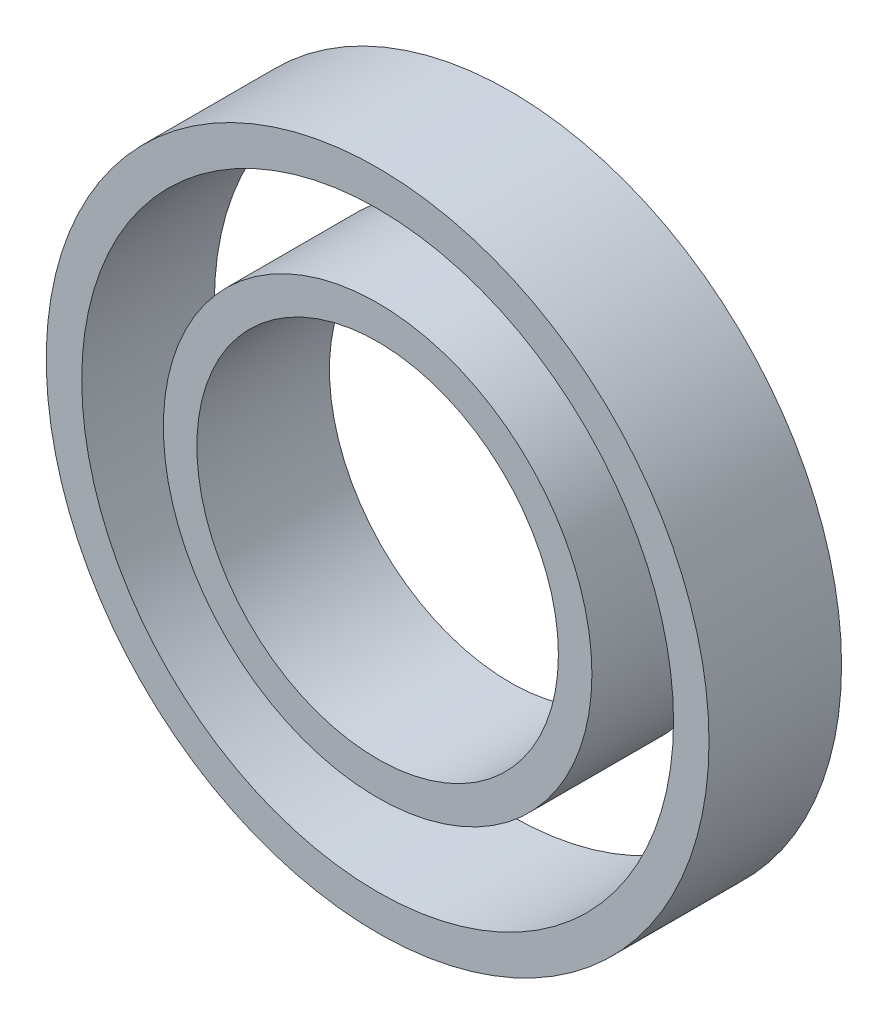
SolidWorks part; units mm, degrees
ref_plane "Front Plane" through (0, 0, 0) normal (0, 0, 1) x (1, 0, 0)
ref_plane "Top Plane" through (0, 0, 0) normal (0, 1, 0) x (1, 0, 0)
ref_plane "Right Plane" through (0, 0, 0) normal (1, 0, 0) x (0, 0, -1)
sketch "Sketch1" plane through (0, 0, 0) normal (0, 0, 1) x (1, 0, 0)
  circle A0 centre (0, 0) radius 29.9974
  circle A1 centre (0, 0) radius 35.56
  circle A2 centre (0, 0) radius 54.991
  circle A3 centre (0, 0) radius 49.1018
  dimension "D1" = 59.9948
  dimension "D2" = 71.12
  dimension "D3" = 109.982
  dimension "D4" = 98.2035
extrude "Extrude2" add sketch "Sketch1" along normal mid plane 21.9964
